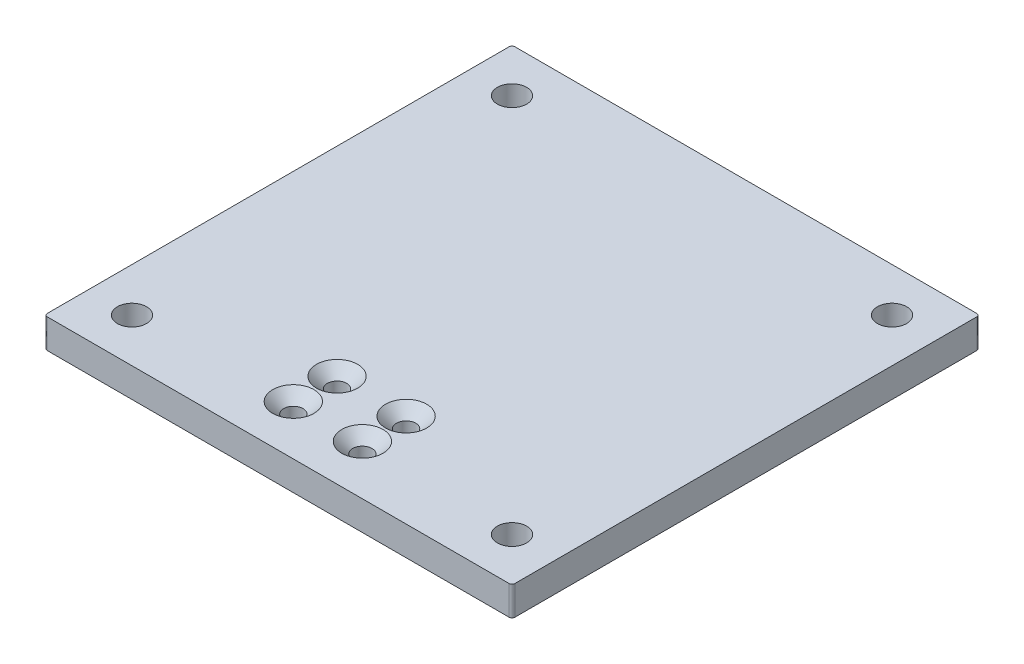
SolidWorks part; units mm, degrees
ref_plane "Front Plane" through (0, 0, 0) normal (0, 0, 1) x (1, 0, 0)
ref_plane "Top Plane" through (0, 0, 0) normal (0, 1, 0) x (1, 0, 0)
ref_plane "Right Plane" through (0, 0, 0) normal (1, 0, 0) x (0, 0, -1)
sketch "Sketch1" plane through (0, 0, 0) normal (0, 1, 0) x (1, 0, 0)
  line L0 (0, 0) -> (0, -151.0491) construction
  line L1 (-101.6, 101.6) -> (101.6, 101.6)
  line L2 (-101.6, 101.6) -> (-101.6, -101.6)
  line L3 (-101.6, -101.6) -> (101.6, -101.6)
  line L4 (101.6, 101.6) -> (101.6, -101.6)
  line L5 (-101.6, 101.6) -> (101.6, -101.6) construction
  line L6 (-101.6, -101.6) -> (101.6, 101.6) construction
  line L7 (-186.8768, 0) -> (164.5062, 0) construction
  circle A5 centre (-82.55, 82.55) radius 6.35
  circle A6 centre (-82.55, -82.55) radius 6.35
  circle A7 centre (82.55, -82.55) radius 6.35
  circle A8 centre (82.55, 82.55) radius 6.35
  dimension "D6" = 12.7
  dimension "D7" = 19.05
  dimension "D1" = 203.2
extrude "Extrude1" add sketch "Sketch1" along normal blind 12.7
sketch "Sketch2" plane through (0, 12.7, 0) normal (0, 1, 0) x (1, 0, 0)
  circle A4 centre (-15, -61) radius 3.4 construction
  circle A5 centre (15, -61) radius 3.4 construction
  circle A6 centre (15, -80) radius 3.4 construction
  circle A7 centre (-15, -80) radius 3.4 construction
hole_wizard "CSK for M8 SFHCS2" positions "3DSketch2" profile "Sketch4" countersink size "M8" standard "Ansi Metric"
sketch3d "3DSketch2"
  circle A0 centre (-15, 12.7, 61) radius 3.4 construction
  point P0 (-15, 12.7, 61)
  point P4 (-15, 16.1, 61)
sketch "Sketch4" plane through (-15, 12.7, 61) normal (1, 0, 0) x (0, 0, 1)
  line L0 (0, 0) -> (0, 12.7)
  line L1 (0, 12.7) -> (4.2, 12.7)
  line L2 (4.2, 12.7) -> (4.2, 4.76)
  line L3 (4.2, 4.76) -> (8.96, 0)
  line L5 (8.96, 0) -> (0, 0)
  line L6 (-4.2, 4.76) -> (-8.96, 0) construction
  line L11 (0, -6.35) -> (0, 107.95) construction
  dimension "Thru Hole Dia." = 8.4
  dimension "Thru Hole Depth" = 12.7
  dimension "Near C'Sink Dia." = 17.92
  dimension "Near C'Sink Angle" = 90
pattern_linear "LPattern1" count 2 spacing 19 along (0, 0, 1) of "CSK for M8 SFHCS2"
mirror "Mirror1" about plane through (0, 0, 0) normal (1, 0, 0) of "LPattern1", "CSK for M8 SFHCS2"
fillet "Fillet1" radius 1.27 4 edges at (-101.6, 6.35, -101.6) (101.6, 6.35, -101.6) (101.6, 6.35, 101.6) (-101.6, 6.35, 101.6)
